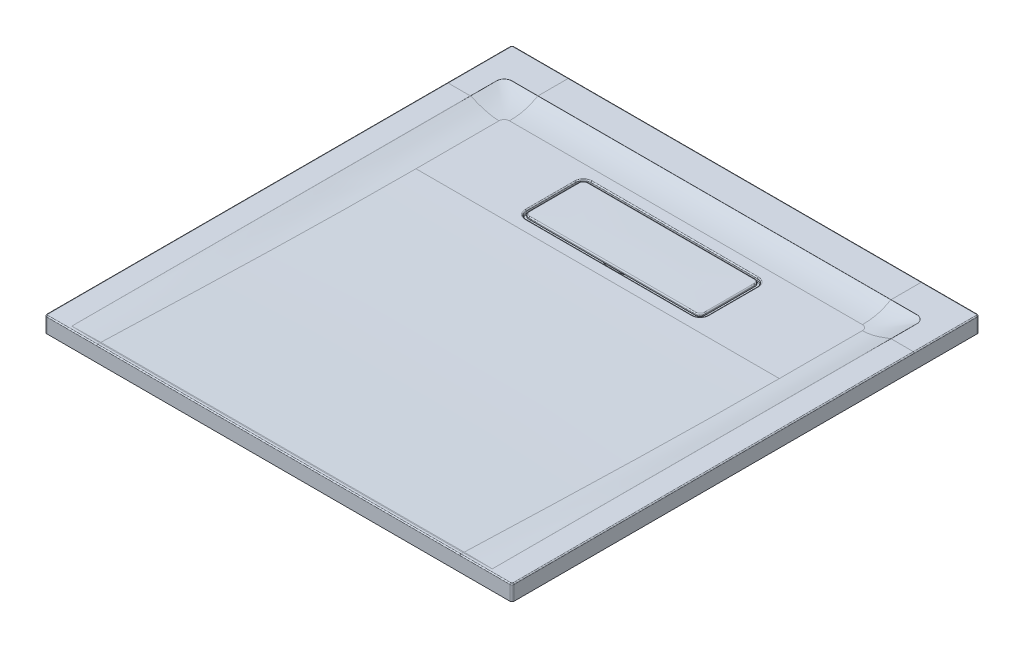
SolidWorks part; units mm, degrees
ref_plane "Płaszczyzna przednia" through (0, 0, 0) normal (0, 0, 1) x (1, 0, 0)
ref_plane "Płaszczyzna górna" through (0, 0, 0) normal (0, 1, 0) x (1, 0, 0)
ref_plane "Płaszczyzna prawa" through (0, 0, 0) normal (1, 0, 0) x (0, 0, -1)
sketch "Szkic1" plane through (0, 0, 0) normal (0, 1, 0) x (1, 0, 0)
  line L0 (0, 250) -> (0, 450) construction
  line L1 (-450, -450) -> (450, -450)
  line L2 (-450, -450) -> (-450, 450)
  line L3 (-450, 450) -> (450, 450)
  line L4 (450, -450) -> (450, 450)
  line L5 (-450, -450) -> (450, 450) construction
  line L6 (-450, 450) -> (450, -450) construction
  line L7 (-160, 187.5) -> (160, 187.5)
  line L8 (-175, 202.5) -> (-175, 297.5)
  line L9 (-160, 312.5) -> (160, 312.5)
  line L10 (175, 202.5) -> (175, 297.5)
  line L11 (-175, 187.5) -> (175, 312.5) construction
  line L12 (-175, 312.5) -> (175, 187.5) construction
  line L13 (-390, 390) -> (390, 390)
  line L14 (405, 375) -> (405, -443)
  line L15 (405, -443) -> (-405, -443)
  line L16 (-405, -443) -> (-405, 375)
  circle A6 centre (0, 250) radius 57.5
  circle A7 centre (0, 250) radius 45
  arc A8 (405, 375) -> (390, 390) centre (390, 375) ccw
  arc A9 (-405, 375) -> (-390, 390) centre (-390, 375) cw
  arc A10 (160, 312.5) -> (175, 297.5) centre (160, 297.5) cw
  arc A11 (175, 202.5) -> (160, 187.5) centre (160, 202.5) cw
  arc A12 (-160, 187.5) -> (-175, 202.5) centre (-160, 202.5) cw
  arc A13 (-175, 297.5) -> (-160, 312.5) centre (-160, 297.5) cw
  point P0 (0, 0)
  point P5 (0, 250)
  dimension "D10" = 115
  dimension "D11" = 90
  dimension "D12" = 15
  dimension "D13" = 15
  dimension "D1" = 900
  dimension "D2" = 900
  dimension "D3" = 200
  dimension "D4" = 125
  dimension "D5" = 350
  dimension "D6" = 60
  dimension "D7" = 45
  dimension "D8" = 45
  dimension "D9" = 7
ref_plane "Płaszczyzna1" through (0, -14, 0) normal (0, 1, 0) x (-1, 0, 0)
ref_plane "korek" through (0, -20.9, 0) normal (0, 1, 0) x (-1, 0, 0)
sketch "Szkic2" plane through (0, 0, 0) normal (0, 1, 0) x (1, 0, 0)
  line L0 (-450, 450) -> (450, 450) construction
  line L1 (-450, -450) -> (-450, 450) construction
  line L2 (-450, -450) -> (450, -450) construction
  line L3 (450, -450) -> (450, 450) construction
  line L5 (405, 375) -> (405, -443) construction
  line L6 (405, -443) -> (-405, -443) construction
  line L7 (-405, -443) -> (-405, 375) construction
  line L8 (-450, 450) -> (450, 450)
  line L9 (-450, -450) -> (-450, 450)
  line L10 (-450, -450) -> (450, -450)
  line L11 (450, -450) -> (450, 450)
  line L12 (-390, 390) -> (390, 390) construction
  line L13 (405, 375) -> (405, -443)
  line L14 (405, -443) -> (-405, -443)
  line L15 (-405, -443) -> (-405, 375)
  line L16 (-390, 390) -> (390, 390)
  arc A0 (405, 375) -> (390, 390) centre (390, 375) ccw construction
  arc A1 (-390, 390) -> (-405, 375) centre (-390, 375) ccw construction
  arc A2 (405, 375) -> (390, 390) centre (390, 375) ccw
  arc A3 (-390, 390) -> (-405, 375) centre (-390, 375) ccw
surface "Powierzchnia-Płaszczyzna1" sketch "Szkic2"
sketch "Szkic3" plane through (0, -14, 0) normal (0, 1, 0) x (-1, 0, 0)
  line L1 (390, -390) -> (-390, -390) construction
  line L2 (-405, -375) -> (-405, 443) construction
  line L3 (-405, 443) -> (405, 443) construction
  line L4 (-175, -202.5) -> (-175, -297.5) construction
  line L5 (160, -312.5) -> (-160, -312.5) construction
  line L6 (175, -202.5) -> (175, -297.5) construction
  line L7 (160, -187.5) -> (-160, -187.5) construction
  line L9 (-350, -165) -> (350, -165)
  line L10 (-350, -165) -> (-350, -325)
  line L11 (-340, -335) -> (340, -335)
  line L12 (350, -165) -> (350, -325)
  line L13 (-350, -165) -> (350, -335) construction
  line L14 (-350, -335) -> (350, -165) construction
  line L16 (405, 443) -> (405, -375) construction
  line L17 (390, -390) -> (-390, -390) construction
  line L18 (-175, -202.5) -> (-175, -297.5)
  line L19 (160, -312.5) -> (-160, -312.5)
  line L20 (175, -202.5) -> (175, -297.5)
  line L21 (160, -187.5) -> (-160, -187.5)
  line L22 (-405, -375) -> (-405, 443) construction
  line L23 (-405, 443) -> (405, 443) construction
  line L24 (405, 443) -> (405, -375) construction
  arc A0 (-175, -297.5) -> (-160, -312.5) centre (-160, -297.5) ccw construction
  arc A1 (160, -312.5) -> (175, -297.5) centre (160, -297.5) ccw construction
  arc A2 (175, -202.5) -> (160, -187.5) centre (160, -202.5) ccw construction
  arc A3 (-160, -187.5) -> (-175, -202.5) centre (-160, -202.5) ccw construction
  arc A4 (-175, -297.5) -> (-160, -312.5) centre (-160, -297.5) ccw
  arc A5 (160, -312.5) -> (175, -297.5) centre (160, -297.5) ccw
  arc A6 (175, -202.5) -> (160, -187.5) centre (160, -202.5) ccw
  arc A7 (-160, -187.5) -> (-175, -202.5) centre (-160, -202.5) ccw
  circle A8 centre (0, -250) radius 45 construction
  circle A9 centre (0, -250) radius 45
  arc A10 (-340, -335) -> (-350, -325) centre (-340, -325) cw
  arc A11 (-405, -375) -> (-390, -390) centre (-390, -375) ccw construction
  arc A12 (390, -390) -> (405, -375) centre (390, -375) ccw construction
  arc A13 (350, -325) -> (340, -335) centre (340, -325) cw
  arc A14 (-405, -375) -> (-390, -390) centre (-390, -375) ccw construction
  arc A15 (390, -390) -> (405, -375) centre (390, -375) ccw construction
  point P26 (0, 0)
  dimension "D3" = 10
  dimension "D4" = 10
  dimension "D1" = 55
  dimension "D2" = 55
surface "Powierzchnia-Płaszczyzna2" sketch "Szkic3"
sketch "Szkic4" plane through (0, 0, 0) normal (0, 1, 0) x (1, 0, 0)
  line L0 (-350, 165) -> (-350, -450)
  line L1 (-450, -450) -> (450, -450) construction
  line L2 (350, 165) -> (350, -450)
  line L3 (350, 165) -> (350, 325) construction
  line L4 (-340, 335) -> (-340, 725)
  line L5 (-350, 325) -> (-740, 325)
  line L6 (340, 335) -> (340, 725)
  line L7 (350, 325) -> (740, 325)
  line L8 (-740, 325) -> (-740, 725) construction
  line L9 (-740, 725) -> (-340, 725) construction
  line L10 (340, 725) -> (740, 725) construction
  line L11 (740, 725) -> (740, 325) construction
  arc A1 (-340, 335) -> (-350, 325) centre (-340, 325) ccw construction
  dimension "D1" = 400
  dimension "D2" = 400
  dimension "D3" = 400
  dimension "D4" = 400
other "Granica-Powierzchnia1"
surface "Powierzchnia-Wyciągnięcie po profilach3"
surface "Powierzchnia-Wyciągnięcie po profilach2"
mirror "Lustro2" about plane through (0, 0, 0) normal (1, 0, 0)
surface "Powierzchnia-Połącz1"
surface "Powierzchnia-Wyciągnięcie po profilach4"
sketch "Szkic5" plane through (0, 0, 0) normal (0, 1, 0) x (1, 0, 0)
  line L0 (-450, -450) -> (-450, 450) construction
  line L1 (-450, 450) -> (450, 450) construction
  line L2 (450, -450) -> (450, 450) construction
  line L3 (-450, -450) -> (450, -450) construction
  line L4 (-450, -450) -> (-450, 450)
  line L5 (-450, 450) -> (450, 450)
  line L6 (450, -450) -> (450, 450)
  line L7 (-450, -450) -> (450, -450)
mirror "Lustro4" about plane through (0, 0, 0) normal (1, 0, 0)
surface "Powierzchnia-Połącz3"
surface "Powierzchnia-Wyciągnięcie1" sketch "Szkic5" parameters "D1"=30
sketch "Szkic6" plane through (0, -14, 0) normal (0, 1, 0) x (-1, 0, 0)
  line L4 (-175, -202.5) -> (-175, -297.5) construction
  line L5 (160, -312.5) -> (-160, -312.5) construction
  line L6 (175, -202.5) -> (175, -297.5) construction
  line L7 (160, -187.5) -> (-160, -187.5) construction
  line L8 (-175, -202.5) -> (-175, -297.5)
  line L9 (160, -312.5) -> (-160, -312.5)
  line L10 (175, -202.5) -> (175, -297.5)
  line L11 (160, -187.5) -> (-160, -187.5)
  arc A0 (-175, -297.5) -> (-160, -312.5) centre (-160, -297.5) ccw construction
  arc A1 (160, -312.5) -> (175, -297.5) centre (160, -297.5) ccw construction
  arc A2 (175, -202.5) -> (160, -187.5) centre (160, -202.5) ccw construction
  arc A3 (-160, -187.5) -> (-175, -202.5) centre (-160, -202.5) ccw construction
  arc A4 (-175, -297.5) -> (-160, -312.5) centre (-160, -297.5) ccw
  arc A5 (160, -312.5) -> (175, -297.5) centre (160, -297.5) ccw
  arc A6 (175, -202.5) -> (160, -187.5) centre (160, -202.5) ccw
  arc A7 (-160, -187.5) -> (-175, -202.5) centre (-160, -202.5) ccw
surface "Powierzchnia-Wyciągnięcie2" sketch "Szkic6"
sketch "Szkic8" plane through (0, 0, 0) normal (1, 0, 0) x (0, 0, -1)
  line L0 (250, 0) -> (250, -30) construction
  line L1 (450, -30) -> (-450, -30) construction
  line L2 (295, -30) -> (295, -28)
  line L3 (295, -28) -> (307.615, -20.9)
  line L4 (250, -30) -> (295, -30) construction
  line L5 (307.615, -20.9) -> (500, -20.9)
  dimension "D1" = 45
  dimension "D2" = 2
  dimension "D3" = 115.23
  dimension "D4" = 20.9
  dimension "D5" = 250
surface "Powierzchnia-Obrót1" sketch "Szkic8" parameters "D1"=360
surface "Powierzchnia-Przytnij1"
surface "Powierzchnia-Płaszczyzna3"
surface "Powierzchnia-Połącz4"
fillet "Zaokrąglenie1" radius 4 4 edges at (-450, -15, 450) (-450, -15, -450) (450, -15, -450) (450, -15, 450)
fillet "Zaokrąglenie2" radius 2 22 edges at (-450, 0, -385.5) (-448.8284, 0, -448.8284) (-393, 0, -450) (0, 0, -450) (393, 0, -450) (448.8284, 0, -448.8284) (450, 0, -385.5) (450, 0, 60.5) (448.8284, 0, 448.8284) (398, 0, 450) (-398, 0, 450) (0, 0, 450) (-448.8284, 0, 448.8284) (-450, 0, 60.5) (-170.6066, -14, -308.1066) (-175, -14, -250) (-170.6066, -14, -191.8934) (0, -14, -187.5) (170.6066, -14, -191.8934) (175, -14, -250) (170.6066, -14, -308.1066) (0, -14, -312.5)
fillet "Zaokrąglenie3" radius 1 8 edges at (0, -20.9, -312.5) (170.6066, -20.9, -308.1066) (175, -20.9, -250) (170.6066, -20.9, -191.8934) (0, -20.9, -187.5) (-170.6066, -20.9, -191.8934) (-175, -20.9, -250) (-170.6066, -20.9, -308.1066)
fillet "Zaokrąglenie4" radius 1 9 edges
fillet "Zaokrąglenie5" radius 1 2 edges at (0, -28, -295) (0, -20.9, -307.615)
fillet "Zaokrąglenie6" radius 55 3 edges
ref_plane "Płaszczyzna2" through (0, -17, 0) normal (0, 1, 0) x (-1, 0, 0)
sketch "Szkic9" plane through (0, -17, 0) normal (0, 1, 0) x (-1, 0, 0)
  line L1 (-160, -192.5) -> (160, -192.5)
  line L2 (-170, -202.5) -> (-170, -297.5)
  line L3 (-160, -307.5) -> (160, -307.5)
  line L4 (170, -202.5) -> (170, -297.5)
  line L5 (-170, -192.5) -> (170, -307.5) construction
  line L6 (-170, -307.5) -> (170, -192.5) construction
  arc A0 (160, -192.5) -> (170, -202.5) centre (160, -202.5) cw
  arc A1 (170, -297.5) -> (160, -307.5) centre (160, -297.5) cw
  arc A2 (-160, -307.5) -> (-170, -297.5) centre (-160, -297.5) cw
  arc A3 (-170, -202.5) -> (-160, -192.5) centre (-160, -202.5) cw
  point P0 (0, -250)
  dimension "D3" = 10
  dimension "D1" = 340
  dimension "D2" = 115
extrude "Dodanie-wyciągnięcie1" add sketch "Szkic9" along normal blind 4 separate body
sketch "Szkic10" plane through (0, 0, 0) normal (1, 0, 0) x (0, 0, -1)
  line L0 (250, -13) -> (250, -12) construction
  line L1 (202.5, -13) -> (297.5, -13) construction
  arc A0 (250, -12) -> (192.5, -13) centre (250, -1665.625) ccw
  arc A1 (250, -12) -> (307.5, -13) centre (250, -1665.625) cw
  dimension "D1" = 1
ref_plane "Płaszczyzna3" through (0, 0, -250) normal (0, 0, -1) x (-1, 0, 0)
sketch "Szkic11" plane through (0, 0, -250) normal (0, 0, -1) x (-1, 0, 0)
  line L0 (0, -13) -> (0, -12) construction
  line L1 (-160, -13) -> (160, -13) construction
  arc A0 (0, -12) -> (-170, -13) centre (0, -14462.5) ccw
  arc A1 (0, -12) -> (170, -13) centre (0, -14462.5) cw
  dimension "D1" = 1
other "Usuń ścianę1"
surface "Powierzchnia-wypełnij1"
surface "Powierzchnia-Połącz5"
fillet "Zaokrąglenie7" radius 2 8 edges
